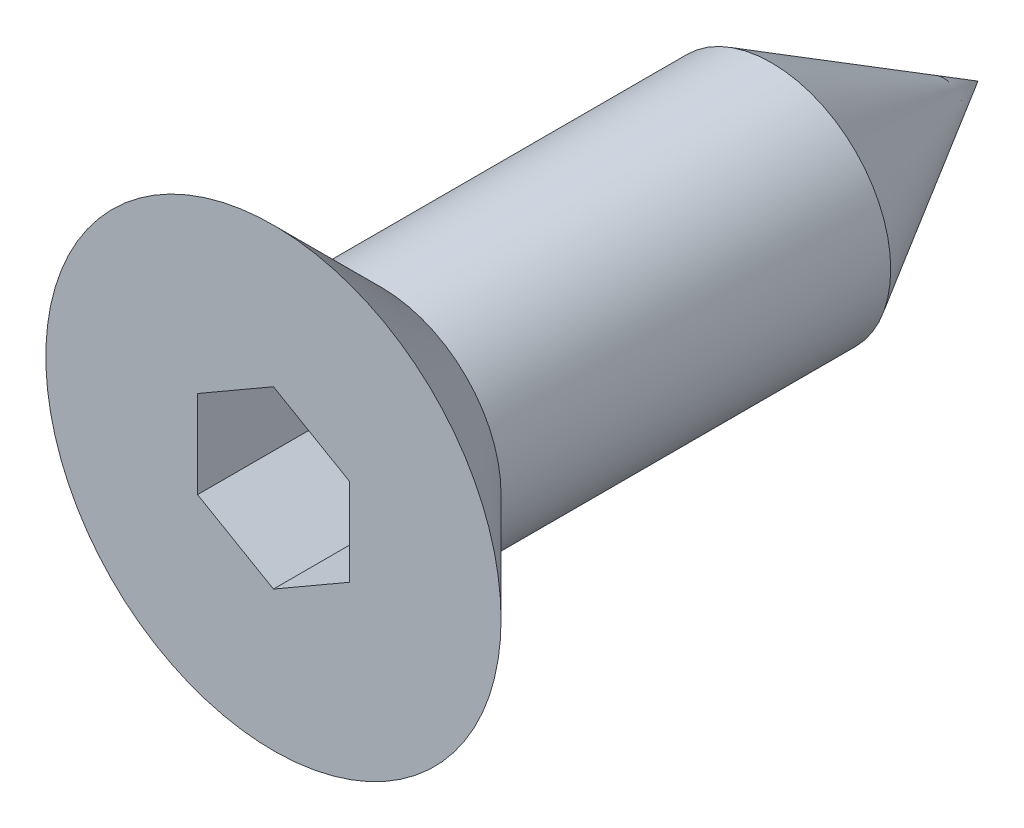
SolidWorks part; units mm, degrees
ref_plane "Plan de face" through (0, 0, 0) normal (0, 0, 1) x (1, 0, 0)
ref_plane "Plan de dessus" through (0, 0, 0) normal (0, 1, 0) x (1, 0, 0)
ref_plane "Plan de droite" through (0, 0, 0) normal (1, 0, 0) x (0, 0, -1)
sketch "Esquisse1" plane through (0, 0, 0) normal (1, 0, 0) x (0, 0, -1)
  line L0 (-1.6035, 0) -> (7.1529, 0) construction
  line L1 (0, 5.0438) -> (0, -4.594) construction
  line L2 (0, 2.1) -> (1, 1.1)
  line L3 (1, 1.1) -> (1, 0)
  line L5 (0, 2.1) -> (8.0645, -5.9645) construction
  line L6 (-1.0465, 1.1) -> (4.1553, 1.1) construction
  line L7 (1, 0) -> (0, 0)
  line L9 (0, 2.1) -> (0, 0)
  dimension "D1" = 45
revolve "Révolution2" add sketch "Esquisse1" angle 360 about L0
sketch "Esquisse3" plane through (0, 0, 0) normal (0, 0, 1) x (1, 0, 0)
  circle A0 centre (0, 0) radius 1.1
extrude "Extrusion1" add sketch "Esquisse3" against normal blind 6.5
sketch "Esquisse2" plane through (0, 0, 0) normal (0, 0, 1) x (1, 0, 0)
  line L1 (0, 0.8083) -> (-0.7, 0.4041)
  line L2 (-0.7, 0.4041) -> (-0.7, -0.4041)
  line L3 (-0.7, -0.4041) -> (0, -0.8083)
  line L4 (0, -0.8083) -> (0.7, -0.4041)
  line L5 (0.7, -0.4041) -> (0.7, 0.4041)
  line L6 (0.7, 0.4041) -> (0, 0.8083)
  circle A0 centre (0, 0) radius 1.8 construction
  circle A1 centre (0, 0) radius 0.7 construction
extrude "Enlèv. mat.-Extru.2" cut sketch "Esquisse2" against normal blind 1.5
chamfer "Chanfrein1" distance 1.1 angle 60 1 edges at (1.1, 0, -6.5)
